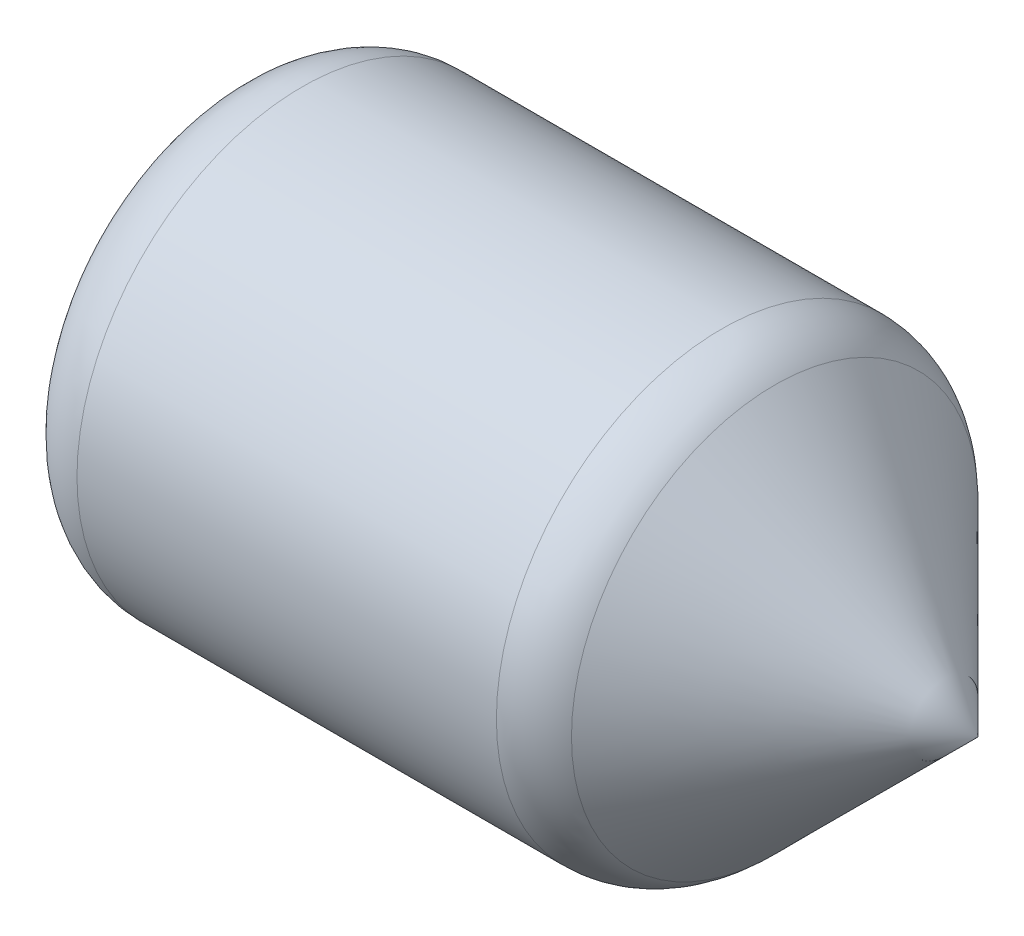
SolidWorks part; units mm, degrees
ref_plane "Front Plane" through (0, 0, 0) normal (0, 0, 1) x (1, 0, 0)
ref_plane "Top Plane" through (0, 0, 0) normal (0, 1, 0) x (1, 0, 0)
ref_plane "Right Plane" through (0, 0, 0) normal (1, 0, 0) x (0, 0, -1)
sketch "Sketch1" plane through (0, 0, 0) normal (0, 1, 0) x (1, 0, 0)
  line L0 (0, 0) -> (100, 0) construction
  line L1 (0, 0) -> (0, 20)
  line L2 (10, 30) -> (65.8579, 30)
  line L3 (72.9289, 27.0711) -> (100, 0)
  line L4 (100, 0) -> (0, 0)
  arc A0 (65.8579, 30) -> (72.9289, 27.0711) centre (65.8579, 20) cw
  arc A1 (0, 20) -> (10, 30) centre (10, 20) cw
  point P7 (70, 30)
  point P10 (0, 30)
  dimension "D4" = 10
  dimension "D1" = 100
  dimension "D2" = 70
  dimension "D3" = 45
revolve "Revolve1" add sketch "Sketch1" angle 360 about L0
